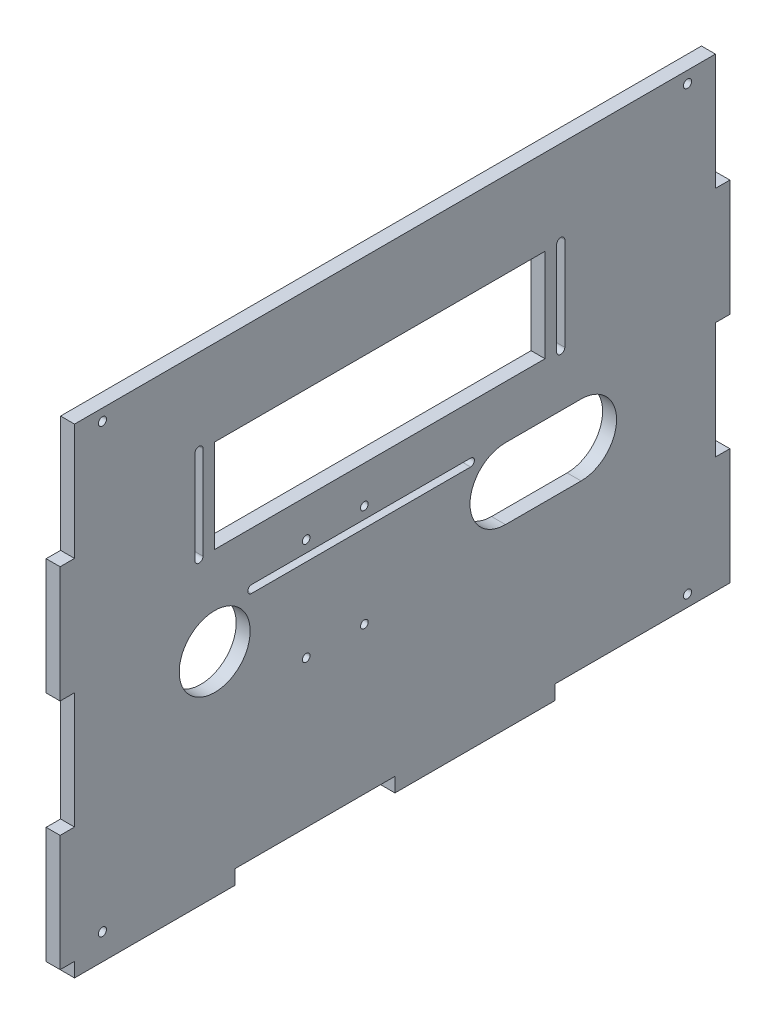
SolidWorks part; units mm, degrees
ref_plane "Alzado" through (0, 0, 0) normal (0, 0, 1) x (1, 0, 0)
ref_plane "Planta" through (0, 0, 0) normal (0, 1, 0) x (1, 0, 0)
ref_plane "Vista lateral" through (0, 0, 0) normal (1, 0, 0) x (0, 0, -1)
sketch "Croquis1" plane through (0, 0, 0) normal (1, 0, 0) x (0, 0, -1)
  line L0 (-1, 0) -> (-1, 12.3829) construction
  line L5 (-124.75, -85.2098) -> (150.75, -85.2098)
  line L6 (-124.75, -85.2098) -> (-124.75, 114.7902)
  line L7 (-124.75, 114.7902) -> (150.75, 114.7902)
  line L8 (150.75, -85.2098) -> (150.75, 114.7902)
  line L9 (-124.75, -85.2098) -> (150.75, 114.7902) construction
  line L10 (-124.75, 114.7902) -> (150.75, -85.2098) construction
  line L11 (93, 15.25) -> (60.5, 15.25)
  line L13 (93, -15.25) -> (60.5, -15.25)
  line L15 (76.75, -14.4007) -> (76.75, -9.0223) construction
  line L16 (-1, 0) -> (8.5392, 0) construction
  line L21 (13, 114.7902) -> (13, 58.1657) construction
  line L35 (13, 14.7902) -> (13, 48) construction
  line L38 (93, 25.25) -> (60.5, 25.25) construction
  line L39 (93, -25.25) -> (60.5, -25.25) construction
  line L40 (-64.5, 25) -> (-64.5, 58) construction
  line L43 (-64.5, 38) -> (77.5, 38)
  line L44 (-64.5, 38) -> (-64.5, 78)
  line L45 (-64.5, 78) -> (77.5, 78)
  line L46 (77.5, 38) -> (77.5, 78)
  line L47 (-73, 78) -> (-73, 38)
  line L48 (-69.5, 78) -> (-69.5, 38)
  line L49 (86, 78) -> (86, 38)
  line L50 (82.5, 78) -> (82.5, 38)
  line L51 (-64.5, -25) -> (-64.5, -58) construction
  line L52 (-124.75, 14.7902) -> (-97.6875, 14.7902) construction
  line L53 (45.5, 17) -> (-48.6148, 17)
  line L54 (45.5, 13.7) -> (-48.6148, 13.7)
  arc A0 (93, -15.25) -> (93, 15.25) centre (93, 0) ccw
  arc A1 (60.5, -15.25) -> (60.5, 15.25) centre (60.5, 0) cw
  circle A2 centre (-64.5, 0) radius 15.25
  circle A5 centre (-64.5, 0) radius 25 construction
  arc A6 (60.5, -25.25) -> (60.5, 25.25) centre (60.5, 0) cw construction
  arc A7 (93, -25.25) -> (93, 25.25) centre (93, 0) ccw construction
  arc A8 (-69.5, 78) -> (-73, 78) centre (-71.25, 78) ccw
  arc A9 (-73, 38) -> (-69.5, 38) centre (-71.25, 38) ccw
  arc A10 (82.5, 38) -> (86, 38) centre (84.25, 38) ccw
  arc A11 (86, 78) -> (82.5, 78) centre (84.25, 78) ccw
  circle A12 centre (138.75, 109.7902) radius 1.75
  circle A13 centre (-112.75, 109.7902) radius 1.75
  circle A14 centre (138.75, -80.2098) radius 1.75
  circle A15 centre (-112.75, -80.2098) radius 1.75
  arc A16 (45.5, 13.7) -> (45.5, 17) centre (45.5, 15.35) ccw
  arc A17 (-48.6148, 17) -> (-48.6148, 13.7) centre (-48.6148, 15.35) ccw
  point P0 (0, 0)
  point P16 (76.75, 15.25)
  point P18 (76.75, -15.25)
  point P22 (108.25, 0)
  point P31 (13, 55.8)
  point P33 (13, 65.25)
  dimension "D5" = 30.5
  dimension "D10" = 30.5
  dimension "D8" = 45
  dimension "D9" = 142
  dimension "D11" = 40
  dimension "D14" = 50
  dimension "D13" = 3.5
  dimension "D17" = 3.5
  dimension "D23" = 3.5
  dimension "D26" = 3.3
  dimension "D29" = 3.3
  dimension "D2" = 200
  dimension "D3" = 125
  dimension "D4" = 64.5
  dimension "D6" = 16.25
  dimension "D7" = 42.5
  dimension "D12" = 20
  dimension "D16" = 33
  dimension "D18" = 40
  dimension "D19" = 5
  dimension "D20" = 2
  dimension "D21" = 5
  dimension "D22" = 33
  dimension "D24" = 12
  dimension "D25" = 5
  dimension "D27" = 21
  dimension "D28" = 15
  dimension "D15" = 10
extrude "Saliente-Extruir1" add sketch "Croquis1" along normal blind 6
ref_plane "Plano4" through (6, 0, 0) normal (1, 0, 0) x (0, 0, -1)
sketch "Croquis2" plane through (6, 0, 0) normal (1, 0, 0) x (0, 0, -1)
  line L1 (8, -11) -> (2, -11)
  line L2 (8, -11) -> (8, 11)
  line L3 (8, 11) -> (2, 11)
  line L4 (2, -11) -> (2, 11)
  line L5 (8, -11) -> (2, 11) construction
  line L6 (8, 11) -> (2, -11) construction
  point P0 (5, 0)
  dimension "D1" = 6
  dimension "D2" = 22
  dimension "D3" = 5
extrude "Saliente-Extruir2" add sketch "Croquis2" along normal blind 18
ref_plane "Plano5" through (0, 11, 0) normal (0, 1, 0) x (1, 0, 0)
sketch "Croquis3" plane through (0, 11, 0) normal (0, 1, 0) x (1, 0, 0)
  line L0 (6, -8.3923) -> (24, 2)
  line L1 (6, -60.9824) -> (6, 60.9824) construction
  line L2 (24, 2) -> (6, 2)
  line L3 (6, 2) -> (6, -8.3923)
  dimension "D1" = 60
extrude "Saliente-Extruir3" add sketch "Croquis3" against normal blind 2
ref_plane "Plano6" through (0, -11, 0) normal (0, -1, 0) x (-1, 0, 0)
sketch "Croquis4" plane through (0, -11, 0) normal (0, -1, 0) x (-1, 0, 0)
  line L0 (-24, 2) -> (-6, -8.3923)
  line L1 (-6, 60.9824) -> (-6, -60.9824) construction
  line L2 (-6, -8.3923) -> (-24, 2) construction
  line L3 (-6, -8.3923) -> (-6, 2)
  line L4 (-24, 2) -> (-6, 2) construction
  line L5 (-6, 2) -> (-24, 2)
extrude "Saliente-Extruir4" add sketch "Croquis4" against normal blind 2
ref_plane "Plano7" through (0, 0, -8) normal (0, 0, -1) x (-1, 0, 0)
sketch "Croquis5" plane through (0, 0, -8) normal (0, 0, -1) x (-1, 0, 0)
  line L2 (-6, 60.9824) -> (-6, -60.9824) construction
  circle A0 centre (-15, 0) radius 4.15
  dimension "D2" = 8.3
  dimension "D1" = 9
extrude "Cortar-Extruir1" cut sketch "Croquis5" against normal up to surface (6 mm away)
pattern_linear "MatrizL1" count 2 spacing 25 along (0, 0, 1) of "Cortar-Extruir1", "Saliente-Extruir4", "Saliente-Extruir3", "Saliente-Extruir2"
ref_plane "Plano8" through (0, 114.7902, 0) normal (0, 1, 0) x (1, 0, 0)
sketch "Croquis11" plane through (6, 0, 0) normal (1, 0, 0) x (0, 0, -1)
  line L0 (-2.25, 114.7902) -> (-2.25, 74.6709) construction
  line L1 (3.3, 114.7902) -> (-3.3, 114.7902) construction
  line L2 (-124.75, 114.7902) -> (-124.75, -85.2098) construction
  dimension "D1" = 122.5
sketch "Croquis19" plane through (6, 0, 0) normal (1, 0, 0) x (0, 0, -1)
  line L0 (-9.4998, -11) -> (9.4998, -11) construction
  line L1 (-8.3923, -11) -> (8, -11)
  line L2 (-8.3923, -11) -> (-8.3923, -26.5)
  line L3 (-8.3923, -26.5) -> (8, -26.5)
  line L4 (8, -11) -> (8, -26.5)
  line L5 (-8.3923, -9) -> (-8.3923, -11) construction
  line L6 (8, -9.9) -> (8, 9.9) construction
  line L7 (0, 0) -> (-12.7396, 0) construction
  line L8 (-17, -11) -> (-17, -26.5)
  line L9 (-33.3923, -26.5) -> (-17, -26.5)
  line L10 (-33.3923, -11) -> (-33.3923, -26.5)
  line L11 (-33.3923, -11) -> (-17, -11)
  line L12 (-17, 26.5) -> (-17, 11)
  line L13 (-33.3923, 11) -> (-17, 11)
  line L14 (-33.3923, 26.5) -> (-33.3923, 11)
  line L15 (-33.3923, 26.5) -> (-17, 26.5)
  line L16 (8, 26.5) -> (8, 11)
  line L17 (-8.3923, 11) -> (8, 11)
  line L18 (-8.3923, 26.5) -> (-8.3923, 11)
  line L19 (-8.3923, 26.5) -> (8, 26.5)
  dimension "D2" = 15.5
  dimension "D3" = 22
  dimension "D1" = 0
  dimension "D5" = 0
  dimension "D6" = 0
  dimension "D7" = 2
  dimension "D8" = 2
extrude "Saliente-Extruir7" add sketch "Croquis19" along normal blind 3
sketch "Croquis20" plane through (6, 0, 0) normal (1, 0, 0) x (0, 0, -1)
  circle A1 centre (-0.1603, -22) radius 1.65
  circle A5 centre (-25.1603, -22) radius 1.65
  circle A6 centre (-25.1603, 22) radius 1.65
  circle A7 centre (-0.1603, 22) radius 1.65
  dimension "D1" = 3.3
  dimension "D3" = 2
  dimension "D2" = 22
  dimension "D4" = 2
extrude "Cortar-Extruir2" cut sketch "Croquis20" against normal through all both and the other way through all
sketch "Croquis22" plane through (0, 0, 0) normal (1, 0, 0) x (0, 0, -1)
  line L0 (-130.95, 14.7902) -> (-130.95, 64.7902)
  line L1 (-55.875, -85.2098) -> (13, -85.2098)
  line L5 (-124.75, 114.7902) -> (-55.875, 114.7902)
  line L6 (-130.95, -85.2098) -> (-130.95, -35.2098)
  line L9 (-124.75, -91.4098) -> (-55.875, -91.4098)
  line L10 (81.875, 114.7902) -> (150.75, 114.7902)
  line L13 (-124.75, -85.2098) -> (-130.95, -85.2098)
  line L16 (13, -91.4098) -> (81.875, -91.4098)
  line L17 (-124.75, -85.2098) -> (-124.75, -91.4098)
  line L18 (-130.95, -91.4098) -> (-130.95, 120.9902) construction
  line L19 (-130.95, -91.4098) -> (156.95, -91.4098) construction
  line L20 (156.95, -91.4098) -> (156.95, 120.9902) construction
  line L21 (-55.875, -85.2098) -> (-55.875, -91.4098)
  line L22 (13, -85.2098) -> (13, -91.4098)
  line L23 (81.875, -85.2098) -> (81.875, -91.4098)
  line L24 (-124.75, -35.2098) -> (-130.95, -35.2098)
  line L25 (-124.75, 14.7902) -> (-130.95, 14.7902)
  line L26 (-124.75, 64.7902) -> (-130.95, 64.7902)
  line L27 (81.875, -85.2098) -> (150.75, -85.2098)
  line L28 (-124.75, -85.2098) -> (150.75, -85.2098) construction
  line L29 (-124.75, -35.2098) -> (-124.75, 14.7902)
  line L30 (-124.75, -85.2098) -> (-124.75, 114.7902) construction
  line L31 (-130.95, 120.9902) -> (156.95, 120.9902) construction
  line L32 (-124.75, 14.7902) -> (-85.721, 14.7902) construction
  line L33 (-124.75, 114.7902) -> (150.75, 114.7902) construction
  line L34 (-55.875, 114.7902) -> (13, 114.7902)
  line L38 (-124.75, 64.7902) -> (-124.75, 114.7902)
  line L39 (13, -85.2098) -> (13, -53.8857) construction
  line L40 (150.75, -85.2098) -> (150.75, 114.7902) construction
  line L41 (150.75, -85.2098) -> (156.95, -85.2098)
  line L42 (156.95, -85.2098) -> (156.95, -35.2098)
  line L43 (150.75, -35.2098) -> (156.95, -35.2098)
  line L44 (150.75, -35.2098) -> (150.75, 14.7902)
  line L45 (150.75, 14.7902) -> (156.95, 14.7902)
  line L46 (156.95, 14.7902) -> (156.95, 64.7902)
  line L47 (150.75, 64.7902) -> (156.95, 64.7902)
  line L48 (150.75, 64.7902) -> (150.75, 114.7902)
  line L49 (13, 114.7902) -> (81.875, 114.7902)
  line L50 (-123.499, 113.3885) -> (144.5637, 113.3885)
  line L51 (-123.499, 113.3885) -> (-123.499, -84.1824)
  line L52 (-123.499, -84.1824) -> (144.5637, -84.1824)
  line L53 (144.5637, 113.3885) -> (144.5637, -84.1824)
  dimension "D4" = 4
  dimension "D5" = 68.875
  dimension "D7" = 50
  dimension "D3" = 6.2
  dimension "D6" = 4
extrude "Saliente-Extruir9" add sketch "Croquis22" along normal blind 6
sketch "Croquis23" plane through (0, 0, -8) normal (0, 0, -1) x (-1, 0, 0)
  line L0 (-6, 118.7185) -> (-6, -118.7185) construction
  line L1 (-33.89, 31.0357) -> (-6, 31.0357)
  line L2 (-33.89, 31.0357) -> (-33.89, -31.6096)
  line L3 (-33.89, -31.6096) -> (-6, -31.6096)
  line L4 (-6, 31.0357) -> (-6, -31.6096)
sketch "Croquis24" plane through (6, 0, 0) normal (1, 0, 0) x (0, 0, -1)
  line L1 (-152.5218, 125.1127) -> (172.3723, 125.1127)
  line L2 (-152.5218, 125.1127) -> (-152.5218, -100.0242)
  line L3 (-152.5218, -100.0242) -> (172.3723, -100.0242)
  line L4 (172.3723, 125.1127) -> (172.3723, -100.0242)
extrude "Cortar-Extruir3" cut sketch "Croquis23" against normal through all
equation "\"ancho\"= 6"
equation "\"D1@Saliente-Extruir1\"=\"ancho\""
